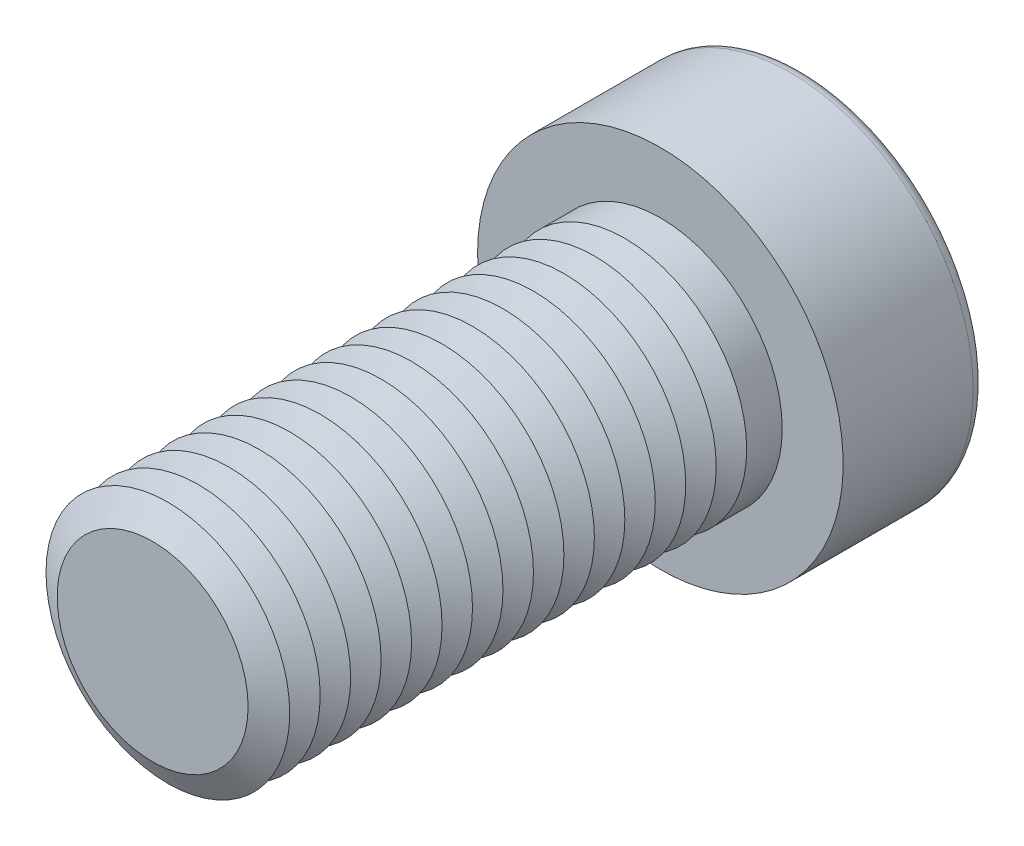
SolidWorks part; units mm, degrees
ref_plane "Front Plane" through (0, 0, 0) normal (0, 0, 1) x (1, 0, 0)
ref_plane "Top Plane" through (0, 0, 0) normal (0, 1, 0) x (1, 0, 0)
ref_plane "Right Plane" through (0, 0, 0) normal (1, 0, 0) x (0, 0, -1)
sketch "Sketch1" plane through (0, 0, 0) normal (0, 0, 1) x (1, 0, 0)
  circle A0 centre (0, 0) radius 12
  dimension "D1" = 24
extrude "Boss-Extrude1" add sketch "Sketch1" along normal blind 50
sketch "Sketch2" plane through (0, 0, 0) normal (0, 0, -1) x (-1, 0, 0)
  circle A0 centre (0, 0) radius 18
  dimension "D1" = 36
extrude "Boss-Extrude2" add sketch "Sketch2" along normal blind 14
sketch "Sketch3" plane through (0, 0, -14) normal (0, 0, -1) x (-1, 0, 0)
  line L1 (-5.4848, 9.5) -> (-10.9697, 0)
  line L2 (-10.9697, 0) -> (-5.4848, -9.5)
  line L3 (-5.4848, -9.5) -> (5.4848, -9.5)
  line L4 (5.4848, -9.5) -> (10.9697, 0)
  line L5 (10.9697, 0) -> (5.4848, 9.5)
  line L6 (5.4848, 9.5) -> (-5.4848, 9.5)
  circle A0 centre (0, 0) radius 9.5 construction
  dimension "D1" = 19
extrude "Cut-Extrude1" cut sketch "Sketch3" against normal blind 14.25
fillet "Fillet1" radius 1.2 1 edges at (-18, 0, -14)
sketch "Sketch4" plane through (0, 0, 0.25) normal (0, 0, -1) x (-1, 0, 0)
  line L0 (5.4848, -9.5) -> (10.9697, 0) construction
  circle A0 centre (0, 0) radius 9.5
extrude "Cut-Extrude2" cut sketch "Sketch4" against normal through all draft 60
sketch "Sketch5" plane through (0, 0, -14) normal (0, 0, -1) x (-1, 0, 0)
  circle A0 centre (0, 0) radius 10.9697
extrude "Cut-Extrude3" cut sketch "Sketch5" against normal through all draft 75
sketch "Sketch7" plane through (0, 0, 0) normal (1, 0, 0) x (0, 0, -1)
  line L25 (-50, 9.4019) -> (-48.5, 12)
  line L26 (-50, 12) -> (-50, -12) construction
  line L27 (-48.5, 12) -> (-51.5, 12)
  line L28 (-51.5, 12) -> (-50, 9.4019)
  line L29 (0, 12) -> (-50, 12) construction
  dimension "D1" = 3
revolve "Cut-Revolve1" cut sketch "Sketch7" angle 360 about axis through (0, 0, 50) along (0, 0, -1)
pattern_linear "LPattern1" count 16 spacing 3 along (0, 0, -1) of "Cut-Revolve1"
